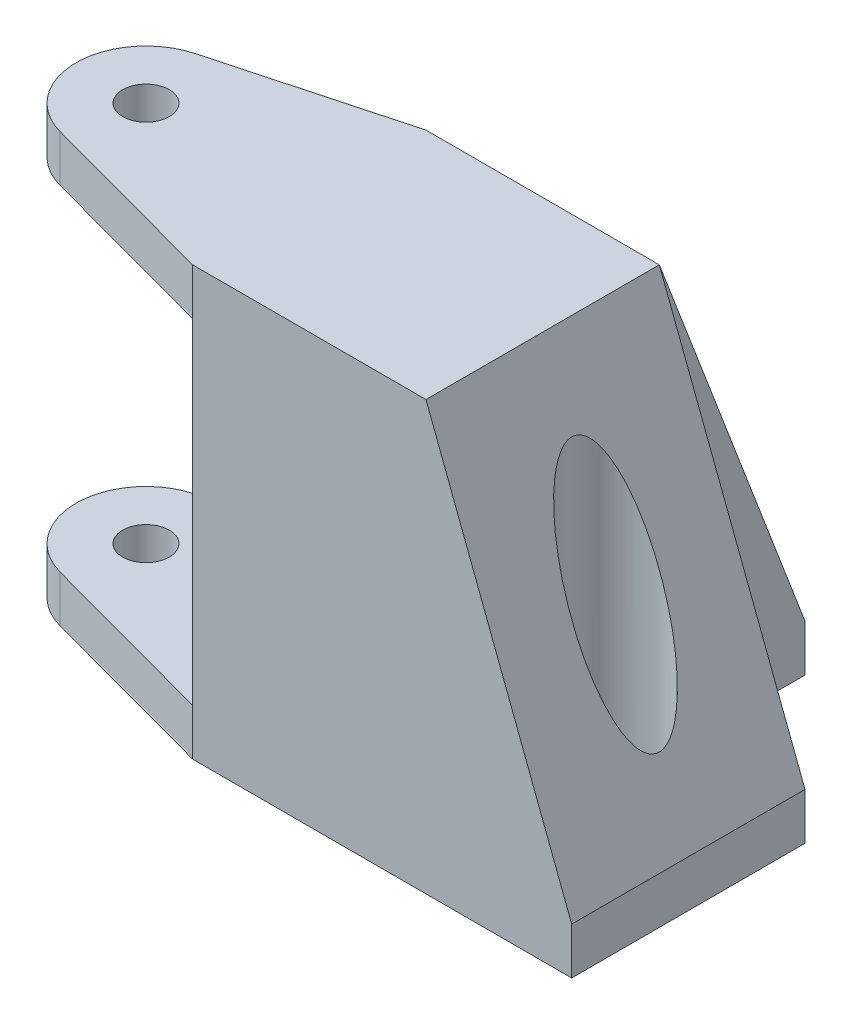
SolidWorks part; units mm, degrees
ref_plane "Front Plane" through (0, 0, 0) normal (0, 0, 1) x (1, 0, 0)
ref_plane "Top Plane" through (0, 0, 0) normal (0, 1, 0) x (1, 0, 0)
ref_plane "Right Plane" through (0, 0, 0) normal (1, 0, 0) x (0, 0, -1)
sketch "Sketch2" plane through (0, 0, 0) normal (0, 0, 1) x (1, 0, 0)
  line L0 (0, 0) -> (-40, 0)
  line L1 (0, 73.3918) -> (24.9782, 8)
  line L2 (24.9782, 8) -> (24.9782, 0)
  line L3 (0, 0) -> (24.9782, 0)
  line L4 (-40, 0) -> (-40, 73.3918)
  line L5 (-40, 73.3918) -> (0, 73.3918)
  dimension "D1" = 40
  dimension "D2" = 8
  dimension "D3" = 70
extrude "Boss-Extrude1" add sketch "Sketch2" along normal blind 40
sketch "Sketch3" plane through (0, 73.3918, 0) normal (0, 1, 0) x (1, 0, 0)
  line L0 (-40, -40) -> (-40, 0) construction
  line L1 (-40, -40) -> (-71.1316, -31.5842)
  line L2 (-40, 0) -> (-71.1316, -8.4158)
  line L3 (-40, 0) -> (-40, -40)
  arc A0 (-71.1316, -31.5842) -> (-71.1316, -8.4158) centre (-68, -20) cw
  point P3 (-80, -20)
  dimension "D2" = 20
  dimension "D1" = 40
extrude "Boss-Extrude2" add sketch "Sketch3" against normal up to vertex (73.3918 mm away) contours L1 A0 L2 L3
sketch "Sketch4" plane through (0, 0, 0) normal (0, 0, 1) x (1, 0, 0)
  line L0 (-40, 73.3918) -> (-40, 65.3918) construction
  line L1 (-40, 73.3918) -> (-40, 0) construction
  line L2 (-40, 73.3918) -> (-71.1316, 73.3918) construction
  line L3 (-40, 0) -> (-40, 8) construction
  line L4 (22, 0) -> (-22, 0) construction
  line L5 (-40, 8) -> (-40, 65.3918)
  line L6 (-40, 65.3918) -> (-80, 65.3918)
  line L7 (-80, 73.3918) -> (-80, 0) construction
  line L8 (-80, 65.3918) -> (-80, 8)
  line L9 (-80, 8) -> (-40, 8)
  dimension "D1" = 8
  dimension "D2" = 8
extrude "Cut-Extrude1" cut sketch "Sketch4" along normal blind 73
sketch "Sketch5" plane through (0, 0, 0) normal (1, 0, 0) x (0, 0, -1)
  line L0 (0, 0) -> (24.9782, 0)
  line L1 (22, 0) -> (-22, 0) construction
  line L2 (24.9782, 0) -> (24.9782, 8)
  line L3 (24.9782, 8) -> (0, 73.3918)
  line L4 (0, 40.3655) -> (0, -40.3655) construction
  line L5 (-40, 73.3918) -> (0, 73.3918) construction
  line L6 (0, 73.3918) -> (0, 0)
  dimension "D1" = 70
  dimension "D2" = 8
extrude "Boss-Extrude3" add sketch "Sketch5" against normal blind 40
sketch "Sketch6" plane through (0, 73.3918, 0) normal (0, 1, 0) x (1, 0, 0)
  circle A0 centre (-68, -20) radius 4
  circle A1 centre (-20, 12.4891) radius 4
  circle A2 centre (12.4891, -20) radius 4
  dimension "D1" = 8
  dimension "D2" = 8
  dimension "D3" = 8
extrude "Cut-Extrude2" cut sketch "Sketch6" against normal through all
ref_plane "Plane1" through (0, 5, 0) normal (0, 1, 0) x (1, 0, 0)
sketch "Sketch8" plane through (0, 5, 0) normal (0, 1, 0) x (1, 0, 0)
  circle A0 centre (-20, 12.4891) radius 7.5
  circle A1 centre (12.4891, -20) radius 7.5
  dimension "D1" = 15
  dimension "D2" = 15
extrude "Cut-Extrude3" cut sketch "Sketch8" along normal through all
